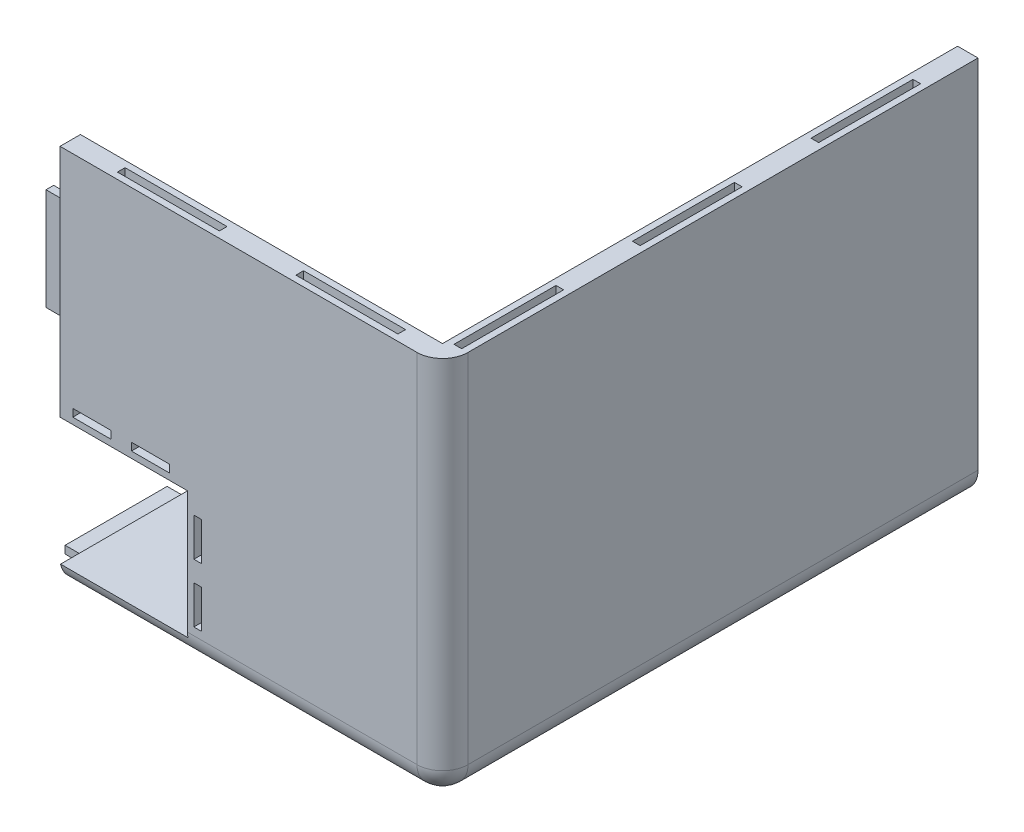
SolidWorks part; units mm, degrees
ref_plane "Alzado" through (0, 0, 0) normal (0, 0, 1) x (1, 0, 0)
ref_plane "Planta" through (0, 0, 0) normal (0, 1, 0) x (1, 0, 0)
ref_plane "Vista lateral" through (0, 0, 0) normal (1, 0, 0) x (0, 0, -1)
sketch "Croquis1" plane through (0, 0, 0) normal (0, 1, 0) x (1, 0, 0)
  line L1 (0, 0) -> (150, 0)
  line L2 (0, 0) -> (0, 210)
  line L3 (0, 210) -> (150, 210)
  line L4 (150, 0) -> (150, 210)
  dimension "D1" = 150
  dimension "D2" = 210
extrude "Saliente-Extruir1" add sketch "Croquis1" along normal blind 150
sketch "Croquis2" plane through (0, 150, 0) normal (0, 1, 0) x (1, 0, 0)
  line L0 (0, 0) -> (150, 0) construction
  line L1 (0, 210) -> (142, 210)
  line L2 (0, 210) -> (0, 8)
  line L3 (0, 8) -> (142, 8)
  line L4 (142, 210) -> (142, 8)
  line L5 (150, 0) -> (150, 210) construction
  dimension "D1" = 8
  dimension "D2" = 8
extrude "Cortar-Extruir1" cut sketch "Croquis2" against normal blind 142
sketch "Croquis3" plane through (0, 150, 0) normal (0, 1, 0) x (1, 0, 0)
  line L0 (0, 8) -> (0, 0) construction
  line L1 (20, 5.5) -> (60, 5.5)
  line L2 (20, 5.5) -> (20, 2.5)
  line L3 (20, 2.5) -> (60, 2.5)
  line L4 (60, 5.5) -> (60, 2.5)
  line L5 (90, 5.5) -> (130, 5.5)
  line L6 (90, 5.5) -> (90, 2.5)
  line L7 (90, 2.5) -> (130, 2.5)
  line L8 (130, 5.5) -> (130, 2.5)
  line L9 (0, 0) -> (150, 0) construction
  line L10 (150, 210) -> (142, 210) construction
  line L11 (144.5, 190) -> (147.5, 190)
  line L12 (144.5, 190) -> (144.5, 150)
  line L13 (144.5, 150) -> (147.5, 150)
  line L14 (147.5, 190) -> (147.5, 150)
  line L15 (147.5, 120) -> (144.5, 120)
  line L16 (147.5, 120) -> (147.5, 80)
  line L17 (147.5, 80) -> (144.5, 80)
  line L18 (144.5, 120) -> (144.5, 80)
  line L19 (147.5, 50) -> (144.5, 50)
  line L20 (147.5, 50) -> (147.5, 10)
  line L21 (147.5, 10) -> (144.5, 10)
  line L22 (144.5, 50) -> (144.5, 10)
  line L23 (150, 0) -> (150, 210) construction
  point P8 (20, 4)
  dimension "D1" = 40
  dimension "D2" = 40
  dimension "D3" = 30
  dimension "D4" = 20
  dimension "D5" = 3
  dimension "D6" = 2.5
  dimension "D7" = 3
  dimension "D8" = 2.5
  dimension "D9" = 40
  dimension "D10" = 40
  dimension "D11" = 40
  dimension "D12" = 30
  dimension "D13" = 20
  dimension "D14" = 30
  dimension "D15" = 3
  dimension "D16" = 3
  dimension "D17" = 3
  dimension "D18" = 2.5
  dimension "D19" = 2.5
  dimension "D20" = 2.5
sketch "Croquis5" plane through (0, 0, 0) normal (-1, 0, 0) x (0, 0, 1)
  line L0 (-210, 8) -> (-210, 0) construction
  line L1 (-190, 5.5) -> (-150, 5.5)
  line L2 (-190, 5.5) -> (-190, 2.5)
  line L3 (-190, 2.5) -> (-150, 2.5)
  line L4 (-150, 5.5) -> (-150, 2.5)
  line L5 (-120, 2.5) -> (-80, 2.5)
  line L6 (-120, 2.5) -> (-120, 5.5)
  line L7 (-120, 5.5) -> (-80, 5.5)
  line L8 (-80, 2.5) -> (-80, 5.5)
  line L9 (-50, 5.5) -> (-10, 5.5)
  line L10 (-50, 5.5) -> (-50, 2.5)
  line L11 (-50, 2.5) -> (-10, 2.5)
  line L12 (-10, 5.5) -> (-10, 2.5)
  line L13 (-5.5, 130) -> (-2.5, 130)
  line L14 (-5.5, 130) -> (-5.5, 90)
  line L15 (-5.5, 90) -> (-2.5, 90)
  line L16 (-2.5, 130) -> (-2.5, 90)
  line L21 (-210, 0) -> (0, 0) construction
  line L22 (-8, 150) -> (0, 150) construction
  line L23 (0, 150) -> (0, 0) construction
  dimension "D1" = 3
  dimension "D2" = 3
  dimension "D3" = 3
  dimension "D4" = 20
  dimension "D5" = 40
  dimension "D6" = 30
  dimension "D7" = 40
  dimension "D8" = 40
  dimension "D9" = 30
  dimension "D10" = 2.5
  dimension "D11" = 2.5
  dimension "D12" = 2.5
  dimension "D14" = 40
  dimension "D15" = 20
  dimension "D17" = 3
  dimension "D20" = 2.5
extrude "Saliente-Extruir3" add sketch "Croquis5" along normal blind 8
sketch "Croquis6" plane through (0, 0, -210) normal (0, 0, -1) x (-1, 0, 0)
  line L0 (-150, 150) -> (-142, 150) construction
  line L1 (-147.5, 130) -> (-144.5, 130)
  line L2 (-147.5, 130) -> (-147.5, 90)
  line L3 (-147.5, 90) -> (-144.5, 90)
  line L4 (-144.5, 130) -> (-144.5, 90)
  line L5 (-147.5, 60) -> (-144.5, 60)
  line L6 (-147.5, 60) -> (-147.5, 20)
  line L7 (-147.5, 20) -> (-144.5, 20)
  line L8 (-144.5, 60) -> (-144.5, 20)
  line L9 (-150, 150) -> (-150, 0) construction
  line L11 (-130, 5.5) -> (-90, 5.5)
  line L12 (-130, 5.5) -> (-130, 2.5)
  line L13 (-130, 2.5) -> (-90, 2.5)
  line L14 (-90, 5.5) -> (-90, 2.5)
  line L15 (-60, 5.5) -> (-20, 5.5)
  line L16 (-60, 5.5) -> (-60, 2.5)
  line L17 (-60, 2.5) -> (-20, 2.5)
  line L18 (-20, 5.5) -> (-20, 2.5)
  line L23 (0, 8) -> (0, 0) construction
  line L24 (-150, 0) -> (0, 0) construction
  point P20 (-90, 4)
  dimension "D1" = 40
  dimension "D2" = 40
  dimension "D3" = 30
  dimension "D4" = 20
  dimension "D5" = 3
  dimension "D6" = 2.5
  dimension "D7" = 3
  dimension "D8" = 2.5
  dimension "D9" = 30
  dimension "D10" = 40
  dimension "D11" = 20
  dimension "D12" = 40
  dimension "D13" = 3
  dimension "D14" = 3
  dimension "D15" = 2.5
  dimension "D16" = 2.5
extrude "Cortar-Extruir2" cut sketch "Croquis6" against normal blind 8
fillet "Redondeo1" radius 10 3 edges at (150, 0, -105) (75, 0, 0) (150, 75, 0)
extrude "Cortar-Extruir3" cut sketch "Croquis3" against normal blind 10
sketch "Croquis7" plane through (0, 0, 0) normal (0, -1, 0) x (1, 0, 0)
  line L2 (-8, -120) -> (-8, -80) construction
  line L3 (80, -80) -> (-8, -80)
  line L4 (80, -80) -> (80, -210)
  line L5 (80, -210) -> (-8, -210)
  line L6 (-8, -80) -> (-8, -210)
  line L7 (140, -210) -> (0, -210) construction
  line L8 (-8, -80) -> (0, -80) construction
  dimension "D1" = 88
  dimension "D2" = 130
extrude "Cortar-Extruir4" cut sketch "Croquis7" against normal blind 10
sketch "Croquis8" plane through (0, 0, 0) normal (0, 0, 1) x (1, 0, 0)
  line L0 (0, 150) -> (0, 10) construction
  line L1 (0, 58) -> (50, 58)
  line L2 (0, 58) -> (0, 8)
  line L3 (0, 8) -> (50, 8)
  line L4 (50, 58) -> (50, 8)
  line L5 (140, 0) -> (0, 0) construction
  dimension "D1" = 8
  dimension "D2" = 50
  dimension "D3" = 50
extrude "Cortar-Extruir5" cut sketch "Croquis8" against normal blind 10
sketch "Croquis9" plane through (0, 0, 0) normal (0, 0, 1) x (1, 0, 0)
  line L0 (0, 150) -> (0, 58) construction
  line L1 (5, 63.5) -> (20, 63.5)
  line L2 (5, 63.5) -> (5, 60.5)
  line L3 (5, 60.5) -> (20, 60.5)
  line L4 (20, 63.5) -> (20, 60.5)
  line L5 (28, 63.5) -> (43, 63.5)
  line L6 (28, 63.5) -> (28, 60.5)
  line L7 (28, 60.5) -> (43, 60.5)
  line L8 (43, 63.5) -> (43, 60.5)
  line L9 (52.5, 51) -> (55.5, 51)
  line L10 (52.5, 51) -> (52.5, 36)
  line L11 (52.5, 36) -> (55.5, 36)
  line L12 (55.5, 51) -> (55.5, 36)
  line L13 (52.5, 28) -> (55.5, 28)
  line L14 (52.5, 28) -> (52.5, 13)
  line L15 (52.5, 13) -> (55.5, 13)
  line L16 (55.5, 28) -> (55.5, 13)
  line L17 (50, 58) -> (0, 58) construction
  line L18 (0, 8) -> (50, 8) construction
  line L19 (50, 10) -> (50, 58) construction
  dimension "D1" = 15
  dimension "D2" = 15
  dimension "D3" = 5
  dimension "D4" = 8
  dimension "D5" = 3
  dimension "D6" = 3
  dimension "D7" = 2.5
  dimension "D8" = 2.5
  dimension "D9" = 15
  dimension "D10" = 15
  dimension "D11" = 5
  dimension "D12" = 3
  dimension "D13" = 3
  dimension "D14" = 2.5
  dimension "D15" = 2.5
  dimension "D16" = 8
extrude "Cortar-Extruir6" cut sketch "Croquis9" against normal blind 6
